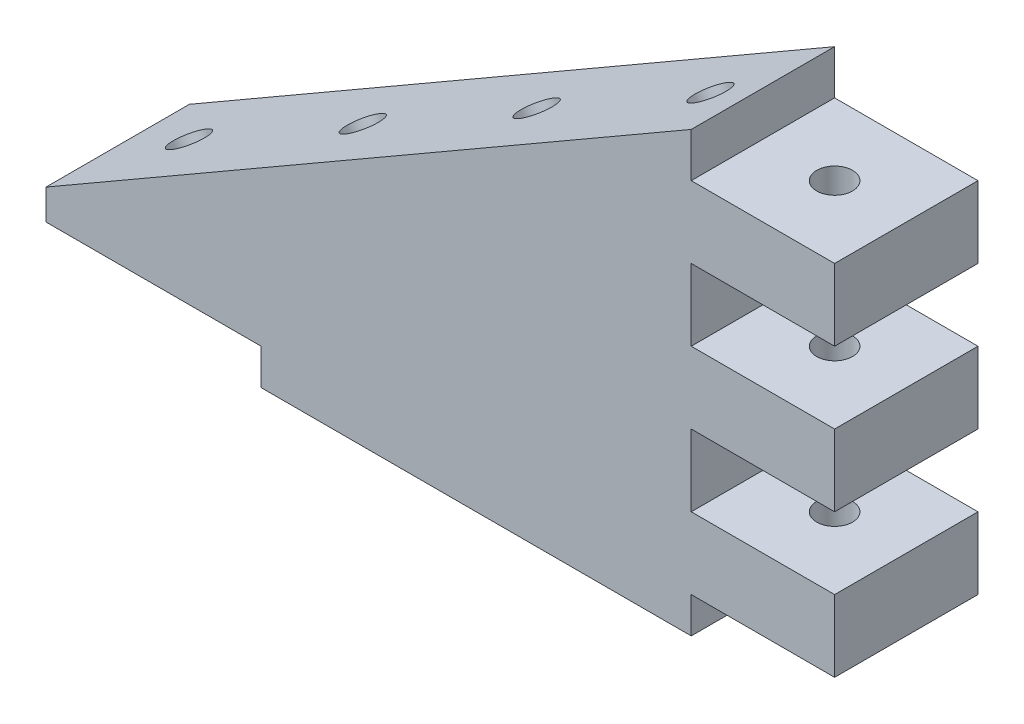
SolidWorks part; units mm, degrees
ref_plane "Front Plane" through (0, 0, 0) normal (0, 0, 1) x (1, 0, 0)
ref_plane "Top Plane" through (0, 0, 0) normal (0, 1, 0) x (1, 0, 0)
ref_plane "Right Plane" through (0, 0, 0) normal (1, 0, 0) x (0, 0, -1)
sketch "Sketch1" plane through (0, 0, 0) normal (0, 0, 1) x (1, 0, 0)
  line L0 (0, 0) -> (0, 66.9615)
  line L1 (0, 66.9615) -> (-115.9808, 0)
  line L2 (-115.9808, 0) -> (0, 0)
  line L3 (-90, 15) -> (0, 15) construction
  line L4 (-90, 15) -> (-90, 0)
  line L5 (0, 66.9615) -> (10, 66.9615)
  line L6 (10, 66.9615) -> (10, 0)
  line L7 (10, 0) -> (0, 0)
  line L8 (-100, 0) -> (-100, 9.2265)
  dimension "D1" = 30
  dimension "D2" = 15
  dimension "D3" = 90
  dimension "D4" = 10
  dimension "D5" = 10
extrude "Boss-Extrude1" add sketch "Sketch1" along normal mid plane 20
sketch "Sketch3" plane through (0, 0, 10) normal (0, 0, 1) x (1, 0, 0)
  line L1 (10, -5) -> (-10, -5)
  line L2 (10, -5) -> (10, 5)
  line L3 (10, 5) -> (-10, 5)
  line L4 (-10, -5) -> (-10, 5)
  line L5 (10, -5) -> (-10, 5) construction
  line L6 (10, 5) -> (-10, -5) construction
  line L14 (-100, 0) -> (10, 0) construction
  point P0 (0, 0)
  dimension "D1" = 20
  dimension "D2" = 5
extrude "Cut-Extrude1" cut sketch "Sketch3" against normal through all
sketch "Sketch4" plane through (0, 0, 10) normal (0, 0, 1) x (1, 0, 0)
  line L0 (0, 66.9615) -> (-100, 9.2265) construction
  line L1 (10, 71.9615) -> (-10, 71.9615)
  line L2 (10, 71.9615) -> (10, 61.9615)
  line L3 (10, 61.9615) -> (-10, 61.9615)
  line L4 (-10, 71.9615) -> (-10, 61.9615)
  line L5 (10, 71.9615) -> (-10, 61.9615) construction
  line L6 (10, 61.9615) -> (-10, 71.9615) construction
  line L7 (0, 66.9615) -> (10, 66.9615) construction
  point P0 (0, 66.9615)
  dimension "D1" = 20
  dimension "D2" = 5
extrude "Cut-Extrude2" cut sketch "Sketch4" against normal through all
sketch "Sketch6" plane through (0, 61.9615, 0) normal (0, 1, 0) x (1, 0, 0)
  circle A0 centre (0, 0) radius 2.5
  dimension "D1" = 5
extrude "Cut-Extrude4" cut sketch "Sketch6" against normal through all
sketch "Sketch7" plane through (-28.9952, 50.2211, 0) normal (-0.5, 0.866, 0) x (0.866, 0.5, 0)
  line L0 (23.4808, -10) -> (23.4808, 10) construction
  line L1 (23.4808, 0) -> (13.4808, 0) construction
  circle A0 centre (13.4808, 0) radius 2.5
  point P2 (23.4808, 0)
  dimension "D1" = 10
  dimension "D2" = 5
extrude "Cut-Extrude5" cut sketch "Sketch7" against normal blind 5
pattern_linear "LPattern1" count 4 spacing 28 along (-0.866, -0.5, 0) of "Cut-Extrude5"
pattern_linear "LPattern2" count 4 spacing 20 along (0, 1, 0) of "Cut-Extrude1"
sketch "Sketch8" plane through (0, 0, 10) normal (0, 0, 1) x (1, 0, 0)
  line L1 (-100, 5) -> (-70, 5)
  line L2 (-70, 5) -> (-70, 0)
  line L3 (10, 5) -> (-10, 5) construction
  line L7 (-100, 0) -> (-100, 9.2265) construction
  line L12 (-100, 5) -> (-100, 0)
  line L13 (-100, 0) -> (-70, 0)
  dimension "D1" = 30
extrude "Cut-Extrude6" cut sketch "Sketch8" against normal through all
sketch "Sketch9" plane through (0, 5, 0) normal (0, -1, 0) x (1, 0, 0)
  line L0 (-70, -10) -> (-70, 10) construction
  line L1 (-100, 0) -> (-70, 0) construction
  line L2 (-100, -10) -> (-100, 10) construction
  circle A0 centre (-80, 0) radius 2.5
  dimension "D1" = 5
  dimension "D2" = 10
extrude "Cut-Extrude7" cut sketch "Sketch9" against normal blind 5
